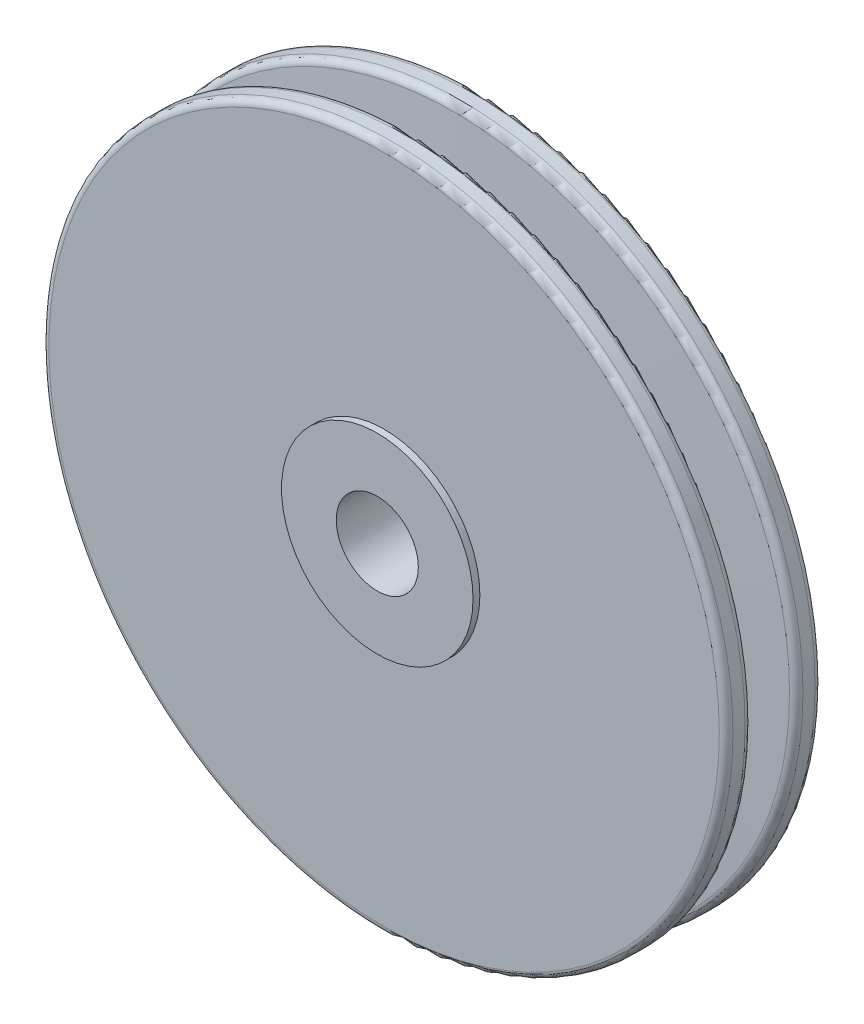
SolidWorks part; units mm, degrees
ref_plane "Спереди" through (0, 0, 0) normal (0, 0, 1) x (1, 0, 0)
ref_plane "Сверху" through (0, 0, 0) normal (0, 1, 0) x (1, 0, 0)
ref_plane "Справа" through (0, 0, 0) normal (1, 0, 0) x (0, 0, -1)
sketch "Эскиз1" plane through (0, 0, 0) normal (1, 0, 0) x (0, 0, -1)
  line L0 (0, 0) -> (3.5, 0) construction
  line L1 (0, 25) -> (0, 0) construction
  line L2 (2.1177, 25) -> (3, 25)
  line L3 (-3.5, 7) -> (-3.5, 24.5)
  line L4 (3.5, 7) -> (3.5, 24.5)
  line L5 (0, 12.75) -> (3.5, 12.75) construction
  line L6 (1.2492, 13.9564) -> (1.618, 24.5174)
  line L7 (-4, 7) -> (-4, 3)
  line L8 (-2.1177, 25) -> (-3, 25)
  line L9 (-1.2492, 13.9564) -> (-1.618, 24.5174)
  line L10 (3.5, 7) -> (4, 7)
  line L11 (4, 7) -> (4, 3)
  line L12 (-3.5, 7) -> (-4, 7)
  line L13 (-4, 3) -> (4, 3)
  arc A0 (-1.2492, 13.9564) -> (1.2492, 13.9564) centre (0, 14) ccw
  arc A1 (3, 25) -> (3.5, 24.5) centre (3, 24.5) cw
  arc A2 (2.1177, 25) -> (1.618, 24.5174) centre (2.1177, 24.5) ccw
  arc A3 (-3, 25) -> (-3.5, 24.5) centre (-3, 24.5) ccw
  arc A4 (-2.1177, 25) -> (-1.618, 24.5174) centre (-2.1177, 24.5) cw
  point P13 (3.5, 25)
  dimension "D6" = 2.5
  dimension "D7" = 0.5
  dimension "D1" = 25
  dimension "D2" = 3
  dimension "D3" = 7
  dimension "D4" = 12.75
  dimension "D5" = 2
  dimension "D8" = 7
  dimension "D9" = 0.5
revolve "Повернуть1" add sketch "Эскиз1" angle 360 about L0
